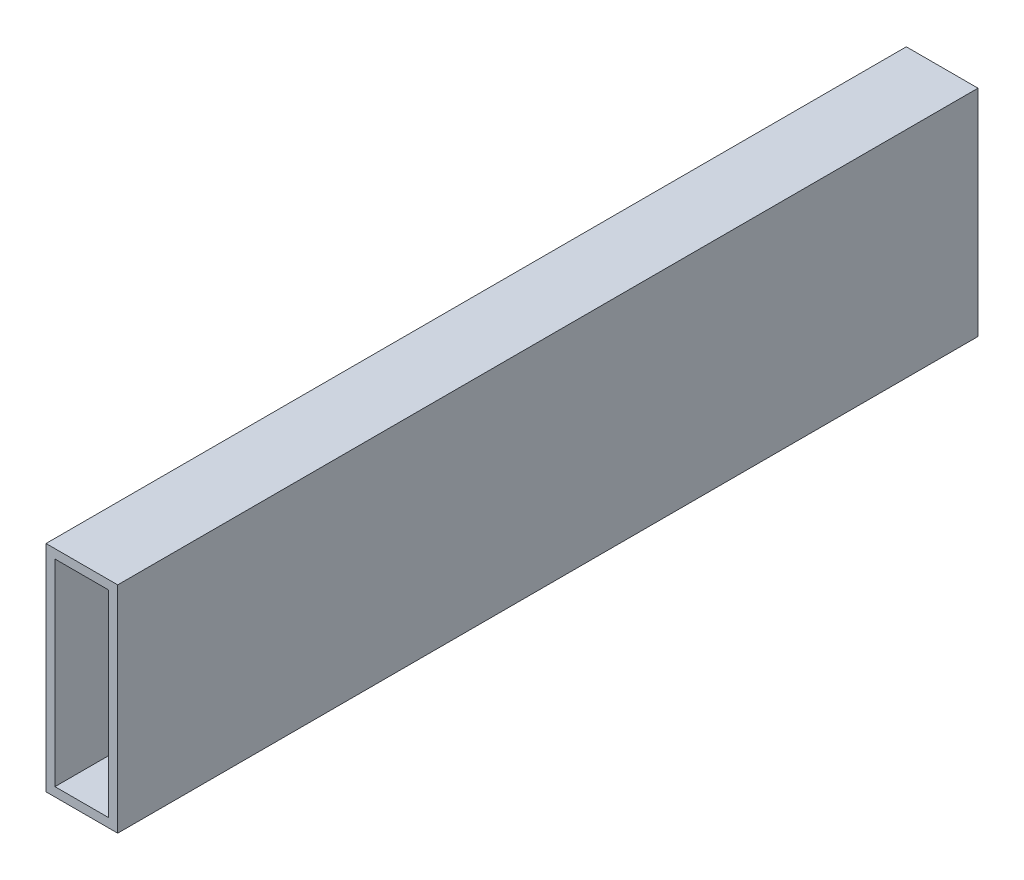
SolidWorks part; units mm, degrees
ref_plane "Plane1" through (0, 0, 0) normal (0, 0, 1) x (1, 0, 0)
ref_plane "Plane2" through (0, 0, 0) normal (0, 1, 0) x (1, 0, 0)
ref_plane "Plane3" through (0, 0, 0) normal (1, 0, 0) x (0, 0, -1)
sketch "Sketch1" plane through (0, 0, 0) normal (0, 0, 1) x (1, 0, 0)
  line L0 (3.175, 3.175) -> (22.225, 3.175)
  line L1 (0, 0) -> (25.4, 0)
  line L2 (0, 0) -> (0, 76.2)
  line L3 (0, 76.2) -> (25.4, 76.2)
  line L4 (25.4, 0) -> (25.4, 76.2)
  line L5 (22.225, 3.175) -> (22.225, 73.025)
  line L6 (3.175, 73.025) -> (22.225, 73.025)
  line L7 (3.175, 3.175) -> (3.175, 73.025)
  dimension "D1" = 76.2
  dimension "D2" = 25.4
  dimension "D3" = 3.175
extrude "Base-Extrude" add sketch "Sketch1" along normal blind 304.8
